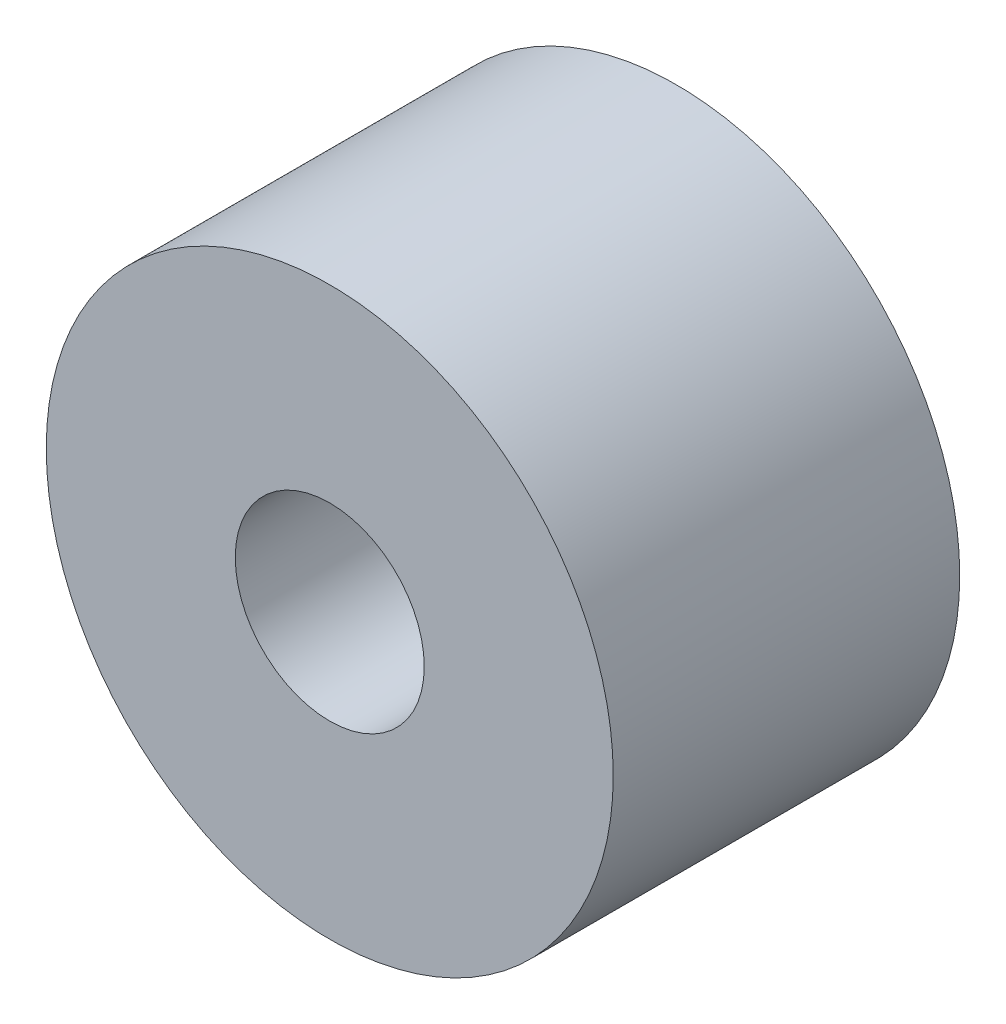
SolidWorks part; units mm, degrees
ref_plane "Front Plane" through (0, 0, 0) normal (0, 0, 1) x (1, 0, 0)
ref_plane "Top Plane" through (0, 0, 0) normal (0, 1, 0) x (1, 0, 0)
ref_plane "Right Plane" through (0, 0, 0) normal (1, 0, 0) x (0, 0, -1)
sketch "Sketch1" plane through (0, 0, 0) normal (1, 0, 0) x (0, 0, -1)
  line L0 (0, 4.95) -> (0, -4.95) construction
  line L1 (-2.5, -1.5) -> (3, -1.5)
  line L2 (-2.5, -1.5) -> (-2.5, -4.5)
  line L3 (-2.5, -4.5) -> (3, -4.5)
  line L4 (3, -1.5) -> (3, -4.5)
  line L5 (2.97, 0) -> (-2.97, 0) construction
  line L6 (0, 0) -> (-8.2563, 0) construction
  line L7 (0, 0) -> (7.3369, 0) construction
  dimension "D1" = 3
  dimension "D2" = 1.5
  dimension "D3" = 4.5
revolve "Revolve1" add sketch "Sketch1" angle 360 about L6
